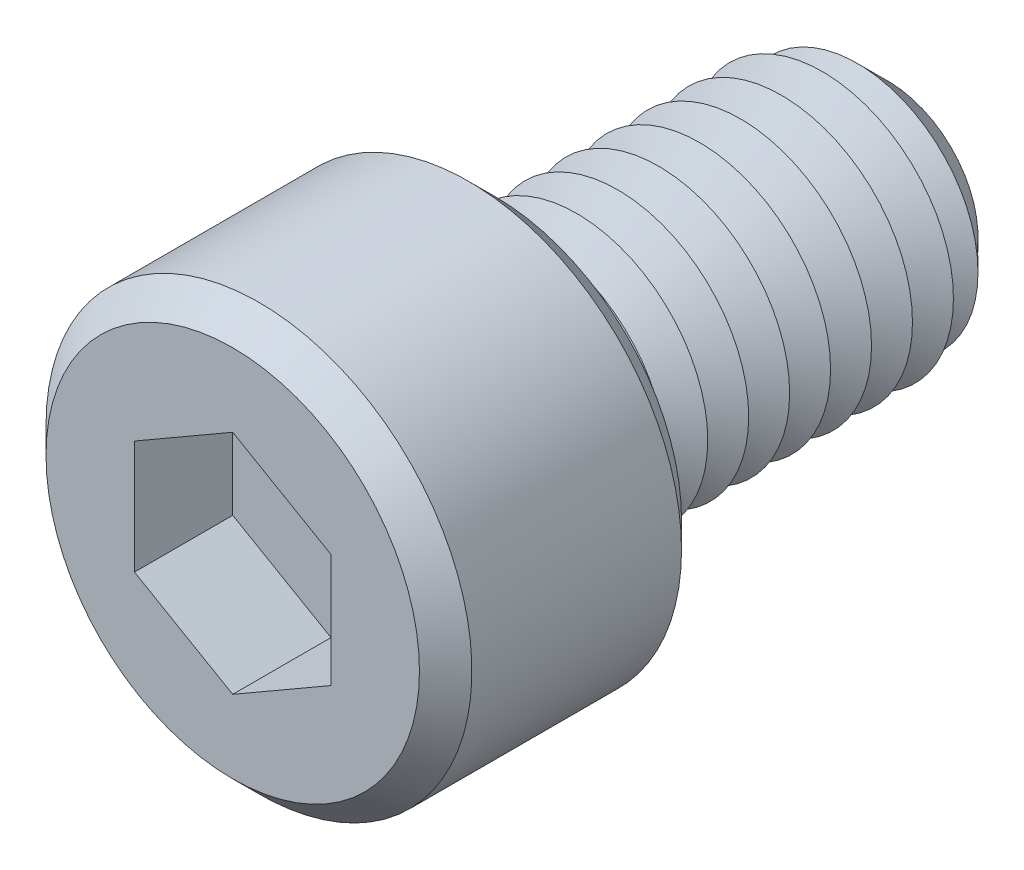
SolidWorks part; units mm, degrees
ref_plane "Front Plane" through (0, 0, 0) normal (0, 0, 1) x (1, 0, 0)
ref_plane "Top Plane" through (0, 0, 0) normal (0, 1, 0) x (1, 0, 0)
ref_plane "Right Plane" through (0, 0, 0) normal (1, 0, 0) x (0, 0, -1)
sketch "Sketch1" plane through (0, 0, 0) normal (0, 0, 1) x (1, 0, 0)
  circle A0 centre (0, 0) radius 6.5
  dimension "D1" = 13
extrude "Boss-Extrude1" add sketch "Sketch1" along normal blind 8
sketch "Sketch2" plane through (0, 0, 0) normal (0, 0, -1) x (-1, 0, 0)
  circle A0 centre (0, 0) radius 4
  dimension "D1" = 8
extrude "Boss-Extrude2" add sketch "Sketch2" along normal blind 12
chamfer "Chamfer1" distance 1.25 angle 45 1 edges at (-4, 0, -12)
sketch "Sketch3" plane through (0, 0, 0) normal (1, 0, 0) x (0, 0, -1)
  line L0 (-2.5121, 0) -> (4.5776, 0) construction
sketch "Sketch4" plane through (0, 0, 0) normal (1, 0, 0) x (0, 0, -1)
  line L0 (0, 4) -> (0.625, 2.9175)
  line L1 (0.625, 2.9175) -> (1.25, 4)
  line L2 (10.75, 4) -> (0, 4) construction
  line L3 (1.25, 4) -> (0, 4)
  dimension "D1" = 1.25
revolve "Cut-Revolve1" cut sketch "Sketch4" angle 360 about L0
pattern_linear "LPattern1" count 9 spacing 1.25 along (0, 0, -1) of "Cut-Revolve1"
sketch "Sketch5" plane through (0, 0, 8) normal (0, 0, 1) x (1, 0, 0)
  line L1 (0, 3.4641) -> (-3, 1.7321)
  line L2 (-3, 1.7321) -> (-3, -1.7321)
  line L3 (-3, -1.7321) -> (0, -3.4641)
  line L4 (0, -3.4641) -> (3, -1.7321)
  line L5 (3, -1.7321) -> (3, 1.7321)
  line L6 (3, 1.7321) -> (0, 3.4641)
  circle A0 centre (0, 0) radius 3 construction
  dimension "D1" = 6
extrude "Cut-Extrude1" cut sketch "Sketch5" against normal blind 3
sketch "Sketch6" plane through (0, 0, 5) normal (0, 0, 1) x (1, 0, 0)
  circle A0 centre (0, 0) radius 0.9
  dimension "D1" = 1.8
extrude "Cut-Extrude2" cut sketch "Sketch6" against normal up to surface (17 mm away)
chamfer "Chamfer2" distance 0.8 angle 45 2 edges at (6.5, 0, 0) (6.5, 0, 8)
